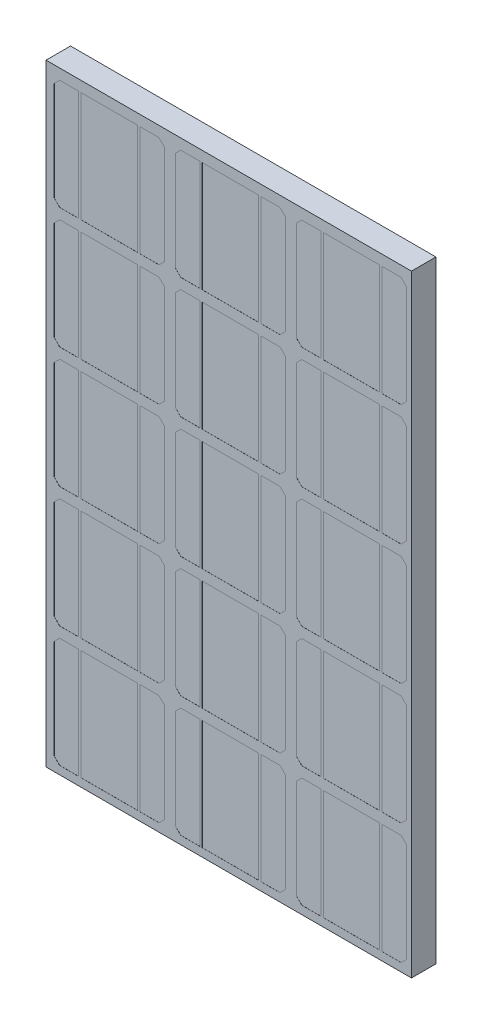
SolidWorks part; units mm, degrees
ref_plane "Plan de face" through (0, 0, 0) normal (0, 0, 1) x (1, 0, 0)
ref_plane "Plan de dessus" through (0, 0, 0) normal (0, 1, 0) x (1, 0, 0)
ref_plane "Plan de droite" through (0, 0, 0) normal (1, 0, 0) x (0, 0, -1)
sketch "Esquisse1" plane through (0, 0, 0) normal (0, 0, 1) x (1, 0, 0)
  line L1 (0, 0) -> (600, 0)
  line L2 (0, 0) -> (0, 750)
  line L3 (0, 750) -> (600, 750)
  line L4 (600, 0) -> (600, 750)
  dimension "D1" = 600
  dimension "D2" = 750
extrude "Boss.-Extru.1" add sketch "Esquisse1" along normal blind 30
sketch "Esquisse2" plane through (0, 0, 30) normal (0, 0, 1) x (1, 0, 0)
  line L0 (349.2368, 48.7276) -> (630.9823, -555.4776) construction
  line L1993 (138.3245, 10) -> (115, 10)
  line L1994 (145, 16.6755) -> (138.3245, 10)
  line L1995 (40, 145) -> (40, 10)
  line L1999 (138.3245, 145) -> (145, 138.3245)
  line L2001 (115, 145) -> (115, 10)
  line L2003 (16.6755, 10) -> (10, 16.6755)
  line L2005 (145, 138.3245) -> (145, 16.6755)
  line L2008 (115, 145) -> (138.3245, 145)
  line L2010 (40, 10) -> (16.6755, 10)
  line L2012 (10, 16.6755) -> (10, 138.3245)
  line L2014 (16.6755, 145) -> (40, 145)
  line L2016 (10, 138.3245) -> (16.6755, 145)
  line L2017 (16.6755, 145) -> (138.3245, 145) construction
  line L2018 (16.6755, 10) -> (138.3245, 10) construction
  line L2019 (0, 0) -> (600, 0) construction
  line L2020 (43, 145) -> (112, 145)
  line L2021 (43, 145) -> (43, 10)
  line L2022 (43, 10) -> (112, 10)
  line L2023 (112, 145) -> (112, 10)
  line L2024 (0, 750) -> (0, 0) construction
  line L2025 (191.3333, 145) -> (191.3333, 10)
  line L2026 (191.3333, 145) -> (260.3333, 145)
  line L2027 (260.3333, 145) -> (260.3333, 10)
  line L2028 (191.3333, 10) -> (260.3333, 10)
  line L2029 (286.6579, 10) -> (263.3333, 10)
  line L2030 (263.3333, 145) -> (263.3333, 10)
  line L2031 (263.3333, 145) -> (286.6579, 145)
  line L2032 (286.6579, 145) -> (293.3333, 138.3245)
  line L2033 (293.3333, 138.3245) -> (293.3333, 16.6755)
  line L2034 (293.3333, 16.6755) -> (286.6579, 10)
  line L2035 (188.3333, 145) -> (188.3333, 10)
  line L2036 (188.3333, 10) -> (165.0088, 10)
  line L2037 (165.0088, 10) -> (158.3333, 16.6755)
  line L2038 (158.3333, 16.6755) -> (158.3333, 138.3245)
  line L2039 (158.3333, 138.3245) -> (165.0088, 145)
  line L2040 (165.0088, 145) -> (188.3333, 145)
  line L2041 (339.6667, 145) -> (339.6667, 10)
  line L2042 (339.6667, 145) -> (408.6667, 145)
  line L2043 (408.6667, 145) -> (408.6667, 10)
  line L2044 (339.6667, 10) -> (408.6667, 10)
  line L2045 (434.9912, 10) -> (411.6667, 10)
  line L2046 (411.6667, 145) -> (411.6667, 10)
  line L2047 (411.6667, 145) -> (434.9912, 145)
  line L2048 (434.9912, 145) -> (441.6667, 138.3245)
  line L2049 (441.6667, 138.3245) -> (441.6667, 16.6755)
  line L2050 (441.6667, 16.6755) -> (434.9912, 10)
  line L2051 (336.6667, 145) -> (336.6667, 10)
  line L2052 (336.6667, 10) -> (313.3421, 10)
  line L2053 (313.3421, 10) -> (306.6667, 16.6755)
  line L2054 (306.6667, 16.6755) -> (306.6667, 138.3245)
  line L2055 (306.6667, 138.3245) -> (313.3421, 145)
  line L2056 (313.3421, 145) -> (336.6667, 145)
  line L2057 (488, 145) -> (488, 10)
  line L2058 (488, 145) -> (557, 145)
  line L2059 (557, 145) -> (557, 10)
  line L2060 (488, 10) -> (557, 10)
  line L2061 (583.3245, 10) -> (560, 10)
  line L2062 (560, 145) -> (560, 10)
  line L2063 (560, 145) -> (583.3245, 145)
  line L2064 (583.3245, 145) -> (590, 138.3245)
  line L2065 (590, 138.3245) -> (590, 16.6755)
  line L2066 (590, 16.6755) -> (583.3245, 10)
  line L2067 (485, 145) -> (485, 10)
  line L2068 (485, 10) -> (461.6755, 10)
  line L2069 (461.6755, 10) -> (455, 16.6755)
  line L2070 (455, 16.6755) -> (455, 138.3245)
  line L2071 (455, 138.3245) -> (461.6755, 145)
  line L2072 (461.6755, 145) -> (485, 145)
  line L2073 (600, 0) -> (600, 750) construction
  line L2074 (40, 293) -> (40, 158)
  line L2075 (40, 158) -> (16.6755, 158)
  line L2076 (16.6755, 158) -> (10, 164.6755)
  line L2077 (10, 164.6755) -> (10, 286.3245)
  line L2078 (10, 286.3245) -> (16.6755, 293)
  line L2079 (16.6755, 293) -> (40, 293)
  line L2080 (43, 293) -> (43, 158)
  line L2081 (43, 293) -> (112, 293)
  line L2082 (112, 293) -> (112, 158)
  line L2083 (43, 158) -> (112, 158)
  line L2084 (138.3245, 158) -> (115, 158)
  line L2085 (115, 293) -> (115, 158)
  line L2086 (115, 293) -> (138.3245, 293)
  line L2087 (138.3245, 293) -> (145, 286.3245)
  line L2088 (145, 286.3245) -> (145, 164.6755)
  line L2089 (145, 164.6755) -> (138.3245, 158)
  line L2090 (188.3333, 293) -> (188.3333, 158)
  line L2091 (188.3333, 158) -> (165.0088, 158)
  line L2092 (165.0088, 158) -> (158.3333, 164.6755)
  line L2093 (158.3333, 164.6755) -> (158.3333, 286.3245)
  line L2094 (158.3333, 286.3245) -> (165.0088, 293)
  line L2095 (165.0088, 293) -> (188.3333, 293)
  line L2096 (191.3333, 293) -> (191.3333, 158)
  line L2097 (191.3333, 158) -> (260.3333, 158)
  line L2098 (260.3333, 293) -> (260.3333, 158)
  line L2099 (191.3333, 293) -> (260.3333, 293)
  line L2100 (286.6579, 158) -> (263.3333, 158)
  line L2101 (263.3333, 293) -> (263.3333, 158)
  line L2102 (263.3333, 293) -> (286.6579, 293)
  line L2103 (286.6579, 293) -> (293.3333, 286.3245)
  line L2104 (293.3333, 286.3245) -> (293.3333, 164.6755)
  line L2105 (293.3333, 164.6755) -> (286.6579, 158)
  line L2106 (336.6667, 293) -> (336.6667, 158)
  line L2107 (336.6667, 158) -> (313.3421, 158)
  line L2108 (313.3421, 158) -> (306.6667, 164.6755)
  line L2109 (306.6667, 164.6755) -> (306.6667, 286.3245)
  line L2110 (306.6667, 286.3245) -> (313.3421, 293)
  line L2111 (313.3421, 293) -> (336.6667, 293)
  line L2112 (339.6667, 293) -> (339.6667, 158)
  line L2113 (339.6667, 158) -> (408.6667, 158)
  line L2114 (408.6667, 293) -> (408.6667, 158)
  line L2115 (339.6667, 293) -> (408.6667, 293)
  line L2116 (434.9912, 158) -> (411.6667, 158)
  line L2117 (411.6667, 293) -> (411.6667, 158)
  line L2118 (411.6667, 293) -> (434.9912, 293)
  line L2119 (434.9912, 293) -> (441.6667, 286.3245)
  line L2120 (441.6667, 286.3245) -> (441.6667, 164.6755)
  line L2121 (441.6667, 164.6755) -> (434.9912, 158)
  line L2122 (485, 293) -> (485, 158)
  line L2123 (485, 158) -> (461.6755, 158)
  line L2124 (461.6755, 158) -> (455, 164.6755)
  line L2125 (455, 164.6755) -> (455, 286.3245)
  line L2126 (455, 286.3245) -> (461.6755, 293)
  line L2127 (461.6755, 293) -> (485, 293)
  line L2128 (488, 293) -> (488, 158)
  line L2129 (488, 158) -> (557, 158)
  line L2130 (557, 293) -> (557, 158)
  line L2131 (488, 293) -> (557, 293)
  line L2132 (583.3245, 158) -> (560, 158)
  line L2133 (560, 293) -> (560, 158)
  line L2134 (560, 293) -> (583.3245, 293)
  line L2135 (583.3245, 293) -> (590, 286.3245)
  line L2136 (590, 286.3245) -> (590, 164.6755)
  line L2137 (590, 164.6755) -> (583.3245, 158)
  line L2138 (40, 441) -> (40, 306)
  line L2139 (40, 306) -> (16.6755, 306)
  line L2140 (16.6755, 306) -> (10, 312.6755)
  line L2141 (10, 312.6755) -> (10, 434.3245)
  line L2142 (10, 434.3245) -> (16.6755, 441)
  line L2143 (16.6755, 441) -> (40, 441)
  line L2144 (43, 441) -> (43, 306)
  line L2145 (43, 441) -> (112, 441)
  line L2146 (112, 441) -> (112, 306)
  line L2147 (43, 306) -> (112, 306)
  line L2148 (138.3245, 306) -> (115, 306)
  line L2149 (115, 441) -> (115, 306)
  line L2150 (115, 441) -> (138.3245, 441)
  line L2151 (138.3245, 441) -> (145, 434.3245)
  line L2152 (145, 434.3245) -> (145, 312.6755)
  line L2153 (145, 312.6755) -> (138.3245, 306)
  line L2154 (188.3333, 441) -> (188.3333, 306)
  line L2155 (188.3333, 306) -> (165.0088, 306)
  line L2156 (165.0088, 306) -> (158.3333, 312.6755)
  line L2157 (158.3333, 312.6755) -> (158.3333, 434.3245)
  line L2158 (158.3333, 434.3245) -> (165.0088, 441)
  line L2159 (165.0088, 441) -> (188.3333, 441)
  line L2160 (191.3333, 441) -> (191.3333, 306)
  line L2161 (191.3333, 306) -> (260.3333, 306)
  line L2162 (260.3333, 441) -> (260.3333, 306)
  line L2163 (191.3333, 441) -> (260.3333, 441)
  line L2164 (286.6579, 306) -> (263.3333, 306)
  line L2165 (263.3333, 441) -> (263.3333, 306)
  line L2166 (263.3333, 441) -> (286.6579, 441)
  line L2167 (286.6579, 441) -> (293.3333, 434.3245)
  line L2168 (293.3333, 434.3245) -> (293.3333, 312.6755)
  line L2169 (293.3333, 312.6755) -> (286.6579, 306)
  line L2170 (336.6667, 441) -> (336.6667, 306)
  line L2171 (336.6667, 306) -> (313.3421, 306)
  line L2172 (313.3421, 306) -> (306.6667, 312.6755)
  line L2173 (306.6667, 312.6755) -> (306.6667, 434.3245)
  line L2174 (306.6667, 434.3245) -> (313.3421, 441)
  line L2175 (313.3421, 441) -> (336.6667, 441)
  line L2176 (339.6667, 441) -> (339.6667, 306)
  line L2177 (339.6667, 306) -> (408.6667, 306)
  line L2178 (408.6667, 441) -> (408.6667, 306)
  line L2179 (339.6667, 441) -> (408.6667, 441)
  line L2180 (434.9912, 306) -> (411.6667, 306)
  line L2181 (411.6667, 441) -> (411.6667, 306)
  line L2182 (411.6667, 441) -> (434.9912, 441)
  line L2183 (434.9912, 441) -> (441.6667, 434.3245)
  line L2184 (441.6667, 434.3245) -> (441.6667, 312.6755)
  line L2185 (441.6667, 312.6755) -> (434.9912, 306)
  line L2186 (485, 441) -> (485, 306)
  line L2187 (485, 306) -> (461.6755, 306)
  line L2188 (461.6755, 306) -> (455, 312.6755)
  line L2189 (455, 312.6755) -> (455, 434.3245)
  line L2190 (455, 434.3245) -> (461.6755, 441)
  line L2191 (461.6755, 441) -> (485, 441)
  line L2192 (488, 441) -> (488, 306)
  line L2193 (488, 306) -> (557, 306)
  line L2194 (557, 441) -> (557, 306)
  line L2195 (488, 441) -> (557, 441)
  line L2196 (583.3245, 306) -> (560, 306)
  line L2197 (560, 441) -> (560, 306)
  line L2198 (560, 441) -> (583.3245, 441)
  line L2199 (583.3245, 441) -> (590, 434.3245)
  line L2200 (590, 434.3245) -> (590, 312.6755)
  line L2201 (590, 312.6755) -> (583.3245, 306)
  line L2202 (40, 589) -> (40, 454)
  line L2203 (40, 454) -> (16.6755, 454)
  line L2204 (16.6755, 454) -> (10, 460.6755)
  line L2205 (10, 460.6755) -> (10, 582.3245)
  line L2206 (10, 582.3245) -> (16.6755, 589)
  line L2207 (16.6755, 589) -> (40, 589)
  line L2208 (43, 589) -> (43, 454)
  line L2209 (43, 589) -> (112, 589)
  line L2210 (112, 589) -> (112, 454)
  line L2211 (43, 454) -> (112, 454)
  line L2212 (138.3245, 454) -> (115, 454)
  line L2213 (115, 589) -> (115, 454)
  line L2214 (115, 589) -> (138.3245, 589)
  line L2215 (138.3245, 589) -> (145, 582.3245)
  line L2216 (145, 582.3245) -> (145, 460.6755)
  line L2217 (145, 460.6755) -> (138.3245, 454)
  line L2218 (188.3333, 589) -> (188.3333, 454)
  line L2219 (188.3333, 454) -> (165.0088, 454)
  line L2220 (165.0088, 454) -> (158.3333, 460.6755)
  line L2221 (158.3333, 460.6755) -> (158.3333, 582.3245)
  line L2222 (158.3333, 582.3245) -> (165.0088, 589)
  line L2223 (165.0088, 589) -> (188.3333, 589)
  line L2224 (191.3333, 589) -> (191.3333, 454)
  line L2225 (191.3333, 454) -> (260.3333, 454)
  line L2226 (260.3333, 589) -> (260.3333, 454)
  line L2227 (191.3333, 589) -> (260.3333, 589)
  line L2228 (286.6579, 454) -> (263.3333, 454)
  line L2229 (263.3333, 589) -> (263.3333, 454)
  line L2230 (263.3333, 589) -> (286.6579, 589)
  line L2231 (286.6579, 589) -> (293.3333, 582.3245)
  line L2232 (293.3333, 582.3245) -> (293.3333, 460.6755)
  line L2233 (293.3333, 460.6755) -> (286.6579, 454)
  line L2234 (336.6667, 589) -> (336.6667, 454)
  line L2235 (336.6667, 454) -> (313.3421, 454)
  line L2236 (313.3421, 454) -> (306.6667, 460.6755)
  line L2237 (306.6667, 460.6755) -> (306.6667, 582.3245)
  line L2238 (306.6667, 582.3245) -> (313.3421, 589)
  line L2239 (313.3421, 589) -> (336.6667, 589)
  line L2240 (339.6667, 589) -> (339.6667, 454)
  line L2241 (339.6667, 454) -> (408.6667, 454)
  line L2242 (408.6667, 589) -> (408.6667, 454)
  line L2243 (339.6667, 589) -> (408.6667, 589)
  line L2244 (434.9912, 454) -> (411.6667, 454)
  line L2245 (411.6667, 589) -> (411.6667, 454)
  line L2246 (411.6667, 589) -> (434.9912, 589)
  line L2247 (434.9912, 589) -> (441.6667, 582.3245)
  line L2248 (441.6667, 582.3245) -> (441.6667, 460.6755)
  line L2249 (441.6667, 460.6755) -> (434.9912, 454)
  line L2250 (485, 589) -> (485, 454)
  line L2251 (485, 454) -> (461.6755, 454)
  line L2252 (461.6755, 454) -> (455, 460.6755)
  line L2253 (455, 460.6755) -> (455, 582.3245)
  line L2254 (455, 582.3245) -> (461.6755, 589)
  line L2255 (461.6755, 589) -> (485, 589)
  line L2256 (488, 589) -> (488, 454)
  line L2257 (488, 454) -> (557, 454)
  line L2258 (557, 589) -> (557, 454)
  line L2259 (488, 589) -> (557, 589)
  line L2260 (583.3245, 454) -> (560, 454)
  line L2261 (560, 589) -> (560, 454)
  line L2262 (560, 589) -> (583.3245, 589)
  line L2263 (583.3245, 589) -> (590, 582.3245)
  line L2264 (590, 582.3245) -> (590, 460.6755)
  line L2265 (590, 460.6755) -> (583.3245, 454)
  line L2266 (40, 737) -> (40, 602)
  line L2267 (40, 602) -> (16.6755, 602)
  line L2268 (16.6755, 602) -> (10, 608.6755)
  line L2269 (10, 608.6755) -> (10, 730.3245)
  line L2270 (10, 730.3245) -> (16.6755, 737)
  line L2271 (16.6755, 737) -> (40, 737)
  line L2272 (43, 737) -> (43, 602)
  line L2273 (43, 737) -> (112, 737)
  line L2274 (112, 737) -> (112, 602)
  line L2275 (43, 602) -> (112, 602)
  line L2276 (138.3245, 602) -> (115, 602)
  line L2277 (115, 737) -> (115, 602)
  line L2278 (115, 737) -> (138.3245, 737)
  line L2279 (138.3245, 737) -> (145, 730.3245)
  line L2280 (145, 730.3245) -> (145, 608.6755)
  line L2281 (145, 608.6755) -> (138.3245, 602)
  line L2282 (188.3333, 737) -> (188.3333, 602)
  line L2283 (188.3333, 602) -> (165.0088, 602)
  line L2284 (165.0088, 602) -> (158.3333, 608.6755)
  line L2285 (158.3333, 608.6755) -> (158.3333, 730.3245)
  line L2286 (158.3333, 730.3245) -> (165.0088, 737)
  line L2287 (165.0088, 737) -> (188.3333, 737)
  line L2288 (191.3333, 737) -> (191.3333, 602)
  line L2289 (191.3333, 602) -> (260.3333, 602)
  line L2290 (260.3333, 737) -> (260.3333, 602)
  line L2291 (191.3333, 737) -> (260.3333, 737)
  line L2292 (286.6579, 602) -> (263.3333, 602)
  line L2293 (263.3333, 737) -> (263.3333, 602)
  line L2294 (263.3333, 737) -> (286.6579, 737)
  line L2295 (286.6579, 737) -> (293.3333, 730.3245)
  line L2296 (293.3333, 730.3245) -> (293.3333, 608.6755)
  line L2297 (293.3333, 608.6755) -> (286.6579, 602)
  line L2298 (336.6667, 737) -> (336.6667, 602)
  line L2299 (336.6667, 602) -> (313.3421, 602)
  line L2300 (313.3421, 602) -> (306.6667, 608.6755)
  line L2301 (306.6667, 608.6755) -> (306.6667, 730.3245)
  line L2302 (306.6667, 730.3245) -> (313.3421, 737)
  line L2303 (313.3421, 737) -> (336.6667, 737)
  line L2304 (339.6667, 737) -> (339.6667, 602)
  line L2305 (339.6667, 602) -> (408.6667, 602)
  line L2306 (408.6667, 737) -> (408.6667, 602)
  line L2307 (339.6667, 737) -> (408.6667, 737)
  line L2308 (434.9912, 602) -> (411.6667, 602)
  line L2309 (411.6667, 737) -> (411.6667, 602)
  line L2310 (411.6667, 737) -> (434.9912, 737)
  line L2311 (434.9912, 737) -> (441.6667, 730.3245)
  line L2312 (441.6667, 730.3245) -> (441.6667, 608.6755)
  line L2313 (441.6667, 608.6755) -> (434.9912, 602)
  line L2314 (485, 737) -> (485, 602)
  line L2315 (485, 602) -> (461.6755, 602)
  line L2316 (461.6755, 602) -> (455, 608.6755)
  line L2317 (455, 608.6755) -> (455, 730.3245)
  line L2318 (455, 730.3245) -> (461.6755, 737)
  line L2319 (461.6755, 737) -> (485, 737)
  line L2320 (488, 737) -> (488, 602)
  line L2321 (488, 602) -> (557, 602)
  line L2322 (557, 737) -> (557, 602)
  line L2323 (488, 737) -> (557, 737)
  line L2324 (583.3245, 602) -> (560, 602)
  line L2325 (560, 737) -> (560, 602)
  line L2326 (560, 737) -> (583.3245, 737)
  line L2327 (583.3245, 737) -> (590, 730.3245)
  line L2328 (590, 730.3245) -> (590, 608.6755)
  line L2329 (590, 608.6755) -> (583.3245, 602)
  dimension "D1" = 30
  dimension "D2" = 30
  dimension "D3" = 3
  dimension "D4" = 3
  dimension "D5" = 135
  dimension "D6" = 10
  dimension "D7" = 10
  dimension "D8" = 6.6755
  dimension "D10" = 23.3245
  dimension "D11" = 10
  dimension "D9" = 4
extrude "Enlèv. mat.-Extru.2" cut sketch "Esquisse2" against normal blind 0.1
sketch "Sketch1" plane through (0, 0, 30) normal (0, 0, 1) x (1, 0, 0)
  line L1 (447.6789, 763.2206) -> (617.19, 763.2206)
  line L2 (447.6789, 763.2206) -> (447.6789, -28.5421)
  line L3 (447.6789, -28.5421) -> (617.19, -28.5421)
  line L4 (617.19, 763.2206) -> (617.19, -28.5421)
extrude "Cut-Extrude1" cut sketch "Sketch1" against normal blind 137
